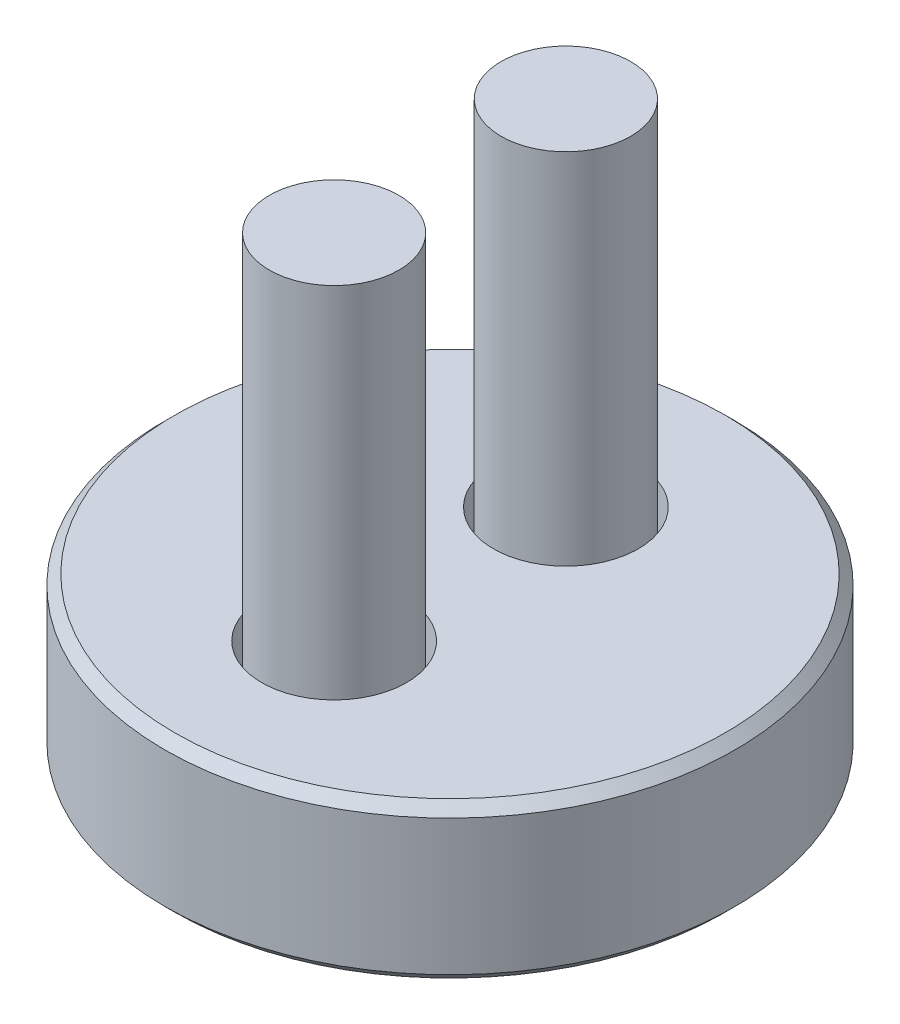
SolidWorks part; units mm, degrees
other "<LHCSM5L16>-<HEX>"
ref_plane "Front Plane" through (0, 0, 0) normal (0, 0, 1) x (1, 0, 0)
ref_plane "Top Plane" through (0, 0, 0) normal (0, 1, 0) x (1, 0, 0)
ref_plane "Right Plane" through (0, 0, 0) normal (1, 0, 0) x (0, 0, -1)
sketch "Sketch1" plane through (0, 0, 0) normal (0, 1, 0) x (1, 0, 0)
  circle A0 centre (0, 0) radius 10.9982
  dimension "D1" = 21.9964
extrude "Extrude1" add sketch "Sketch1" along normal blind 5.9944
chamfer "Chamfer1" distance 0.381 angle 45 2 edges at (0, 0, 10.9982) (0, 5.9944, 10.9982)
sketch "Sketch2" plane through (0, 0, 0) normal (0, -1, 0) x (1, 0, 0)
  line L0 (0, 4.4704) -> (0, 0) construction
  line L1 (0, 0) -> (0, -4.4704) construction
  circle A0 centre (0, 4.4704) radius 2.794
  circle A1 centre (0, -4.4704) radius 2.794
  dimension "D1" = 5.588
  dimension "D2" = 4.4704
extrude "Extrude2" cut sketch "Sketch2" against normal through all
sketch "Sketch3" plane through (0, 0, 0) normal (0, -1, 0) x (1, 0, 0)
  line L0 (0, -4.4704) -> (0, 4.4704) construction
  line L1 (4.572, -4.4704) -> (4.572, 4.4704)
  line L2 (-4.572, -4.4704) -> (-4.572, 4.4704)
  arc A0 (4.572, -4.4704) -> (-4.572, -4.4704) centre (0, -4.4704) cw
  arc A1 (4.572, 4.4704) -> (-4.572, 4.4704) centre (0, 4.4704) ccw
  dimension "D1" = 4.572
  dimension "D2" = 4.572
extrude "Extrude3" cut sketch "Sketch3" against normal blind 3.6322
inserted part "LHCSM5L16"
move or copy body "Body-Move/Copy2" placed by mates yes
mirror "Mirror1" about plane through (0, 0, 0) normal (0, 0, 1)
